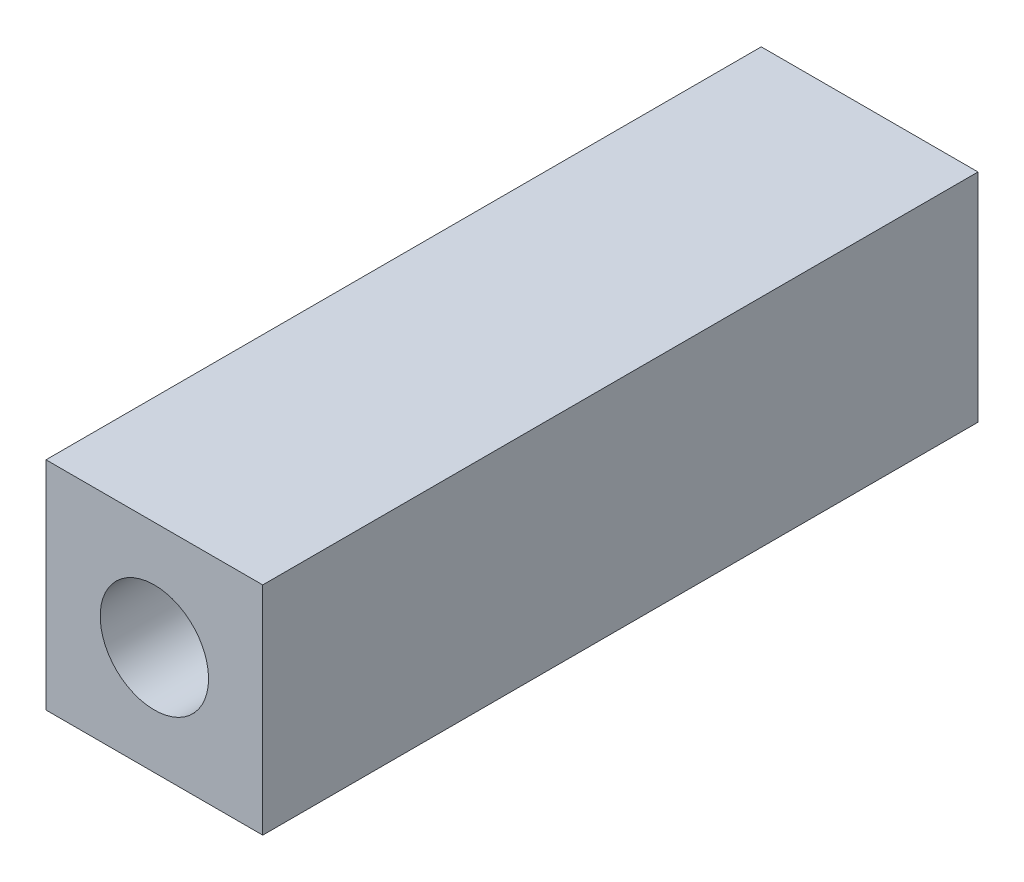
SolidWorks part; units mm, degrees
ref_plane "Front Plane" through (0, 0, 0) normal (0, 0, 1) x (1, 0, 0)
ref_plane "Top Plane" through (0, 0, 0) normal (0, 1, 0) x (1, 0, 0)
ref_plane "Right Plane" through (0, 0, 0) normal (1, 0, 0) x (0, 0, -1)
sketch "Sketch1" plane through (0, 0, 0) normal (0, 0, 1) x (1, 0, 0)
  line L1 (6.35, -6.35) -> (-6.35, -6.35)
  line L2 (6.35, -6.35) -> (6.35, 6.35)
  line L3 (6.35, 6.35) -> (-6.35, 6.35)
  line L4 (-6.35, -6.35) -> (-6.35, 6.35)
  line L5 (6.35, -6.35) -> (-6.35, 6.35) construction
  line L6 (6.35, 6.35) -> (-6.35, -6.35) construction
  circle A0 centre (0, 0) radius 3.175
  dimension "D2" = 6.35
  dimension "D1" = 12.7
extrude "Boss-Extrude1" add sketch "Sketch1" along normal blind 41.91 contours L3 L4 L1 L2 | A0
